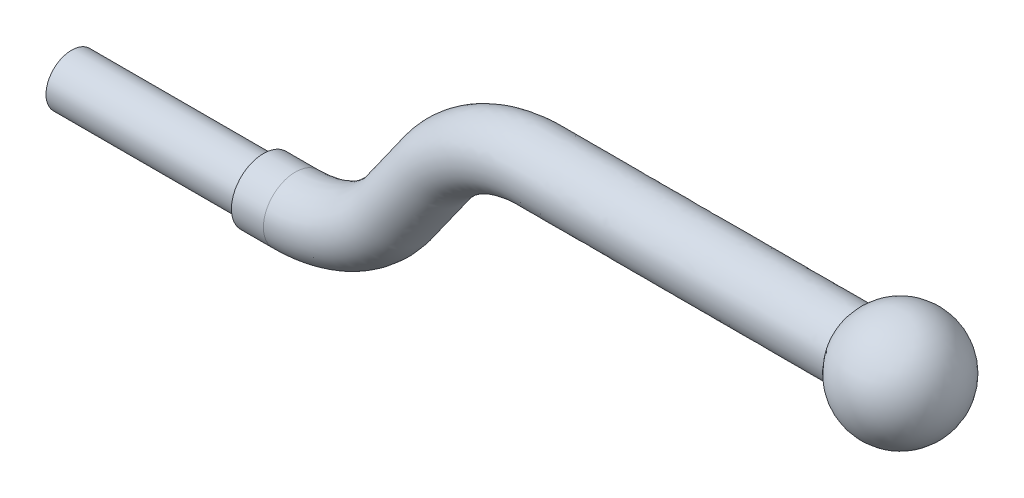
SolidWorks part; units mm, degrees
ref_plane "Front Plane" through (0, 0, 0) normal (0, 0, 1) x (1, 0, 0)
ref_plane "Top Plane" through (0, 0, 0) normal (0, 1, 0) x (1, 0, 0)
ref_plane "Right Plane" through (0, 0, 0) normal (1, 0, 0) x (0, 0, -1)
sketch "Sketch1" plane through (0, 0, 0) normal (0, 0, 1) x (1, 0, 0)
  line L0 (-52.7425, 0) -> (-17.7425, 0)
  line L1 (-1.434, 8.4229) -> (4.3546, 16.5771)
  line L2 (20.6632, 25) -> (70.2575, 25)
  line L3 (-17.7425, 0) -> (-52.7425, 0)
  line L4 (-52.7425, 0) -> (-22.7425, 0)
  arc A0 (4.3546, 16.5771) -> (20.6632, 25) centre (20.6632, 5) cw
  arc A1 (-17.7425, 0) -> (-1.434, 8.4229) centre (-17.7425, 20) ccw
  point P9 (0, 0)
  dimension "D1" = 20
  dimension "D2" = 10
  dimension "D3" = 35
  dimension "D4" = 30
  dimension "D5" = 25
  dimension "D6" = 123
sketch3d "3DSketch2"
  line L0 (20.6632, 25, 0) -> (70.2575, 25, 0) construction
  circle A0 centre (70.2575, 25, 0) radius 5
  point P4 (65.2575, 25, 0)
  dimension "D1" = 10
sweep "Sweep3" add profiles "3DSketch2" path "Sketch1"
sketch "Sketch11" plane through (-17.7425, 0, 0) normal (-1, 0, 0) x (0, 0, 1)
  circle A0 centre (0, 0) radius 5
extrude "Boss-Extrude1" add sketch "Sketch11" along normal blind 5
sketch "Sketch12" plane through (-22.7425, 0, 0) normal (-1, 0, 0) x (0, 0, 1)
  circle A0 centre (0, 0) radius 4
  dimension "D1" = 8
extrude "Boss-Extrude2" add sketch "Sketch12" along normal blind 30
sketch "Sketch13" plane through (70.2575, 0, 0) normal (1, 0, 0) x (0, 0, -1)
  circle A2 centre (0, 25) radius 5
extrude "Boss-Extrude4" add sketch "Sketch13" along normal blind 6.6
sketch "Sketch14" plane through (76.8575, 0, 0) normal (1, 0, 0) x (0, 0, -1)
  line L0 (0, 16.4) -> (0, 33.6)
  arc A2 (0, 16.4) -> (0, 33.6) centre (0, 25) ccw
  dimension "D1" = 17.2
revolve "Revolve1" add sketch "Sketch14" angle 360 about L0
sketch3d "3DSketch1"
  line L0 (20.6632, 25, 0) -> (70.2575, 25, 0) construction
  circle A0 centre (70.2575, 25, 0) radius 5
  point P4 (65.2575, 25, 0)
  point P7 (0, 0, 0)
  dimension "D1" = 10
